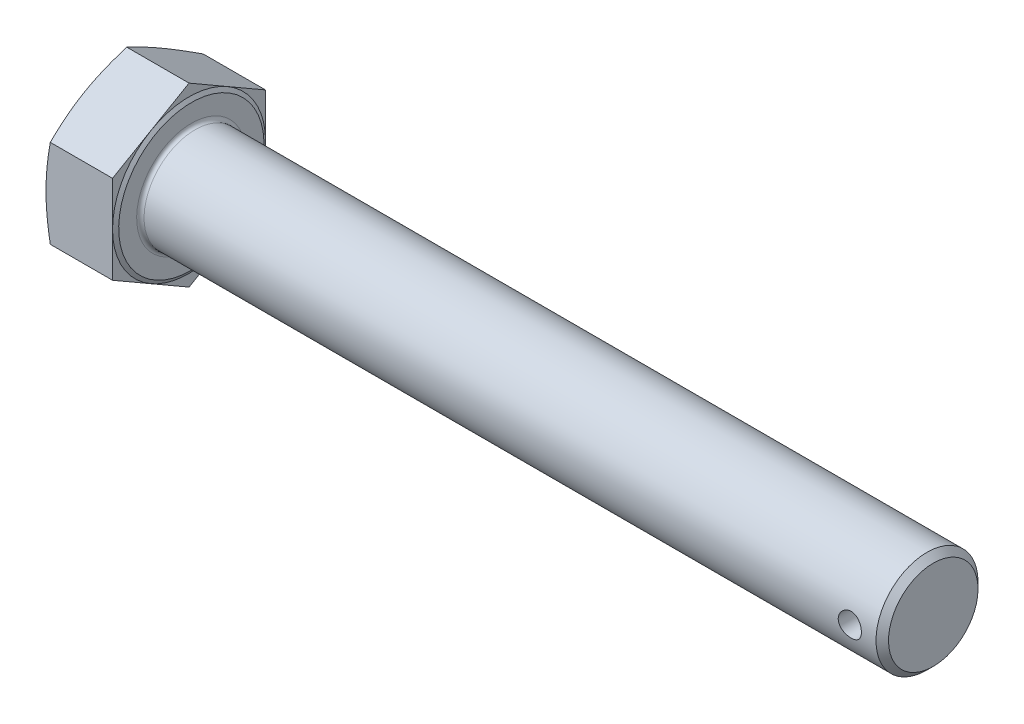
SolidWorks part; units mm, degrees
ref_plane "Front" through (0, 0, 0) normal (0, 0, 1) x (1, 0, 0)
ref_plane "Top" through (0, 0, 0) normal (0, 1, 0) x (1, 0, 0)
ref_plane "Right" through (0, 0, 0) normal (1, 0, 0) x (0, 0, -1)
sketch "Sketch-BaseHead" plane through (0, 0, 0) normal (1, 0, 0) x (0, 0, -1)
  line L1 (0, -19.0526) -> (16.5, -9.5263)
  line L2 (16.5, -9.5263) -> (16.5, 9.5263)
  line L3 (16.5, 9.5263) -> (0, 19.0526)
  line L4 (0, 19.0526) -> (-16.5, 9.5263)
  line L5 (-16.5, 9.5263) -> (-16.5, -9.5263)
  line L6 (-16.5, -9.5263) -> (0, -19.0526)
  circle A0 centre (0, 0) radius 16.5 construction
  dimension "s" = 33
extrude "BaseHead" add sketch "Sketch-BaseHead" along normal blind 14.35
sketch "Sketch4" plane through (-0.2646, -5.9169, 0) normal (0, 0, 1) x (0, 1, 0)
  line L0 (5.9169, 3.7369) -> (5.9169, -10.4477) construction
  line L2 (24.9695, -0.2646) -> (22.4169, -0.2646)
  line L4 (22.4169, -0.2646) -> (24.9695, -1.1937)
  line L6 (24.9695, -1.1937) -> (24.9695, -0.2646)
  dimension "D1" = 20
  dimension "D2" = 33
revolve "HeadChamfer" cut sketch "Sketch4" angle 360 about L0
sketch "Sketch1" plane through (0, 0, 0) normal (0, 1, 0) x (1, 0, 0)
  line L0 (14.35, 0) -> (14.85, 0)
  line L1 (14.85, 0) -> (14.85, 15.675)
  line L2 (14.85, 15.675) -> (14.35, 16.5)
  line L3 (14.35, 16.5) -> (14.35, 0)
  line L6 (-4.0016, 0) -> (10.1831, 0) construction
  dimension "D1" = 16.5
  dimension "D2" = 15.675
  dimension "D3" = 0.5
revolve "Revolve1" add sketch "Sketch1" angle 360 about axis through (-4.0016, 0, 0) along (1, 0, 0)
ref_plane "Plane2" through (118.85, 0, 0) normal (1, 0, 0) x (0, 0, -1)
sketch "Sketch3" plane through (14.85, 0, 0) normal (1, 0, 0) x (0, 0, -1)
  circle A0 centre (0, 0) radius 11
  dimension "d" = 22
extrude "BaseBody" add sketch "Sketch3" along normal blind 160
chamfer "Chamfer1" distance 1.353 angle 45 1 edges at (174.85, 11, 0)
fillet "HeadFillet" radius 0.8 1 edges at (14.85, -11, 0)
sketch "Sketch5" plane through (0, 0, 0) normal (0, 0, 1) x (1, 0, 0)
  line L2 (14.85, -15.675) -> (14.85, 15.675) construction
  line L3 (173.497, 0) -> (15.65, 0) construction
  circle A0 centre (167.85, 0) radius 2.5
  dimension "d1" = 5
  dimension "lh" = 153
extrude "Hole" cut sketch "Sketch5" against normal through all and the other way through all
equation "\"D1@Sketch1\" = \"s@Sketch-BaseHead\" / 2"
equation "\"D2@Sketch4\" = \"s@Sketch-BaseHead\""
equation "\"D1@Chamfer1\" = (  \"d@Sketch3\"  -\"D2@ThreadCosmetic1\" ) / 2 "
equation "\"b@ThreadCosmetic1\" = \"l@BaseBody\" - \"lg@Plane2\""
